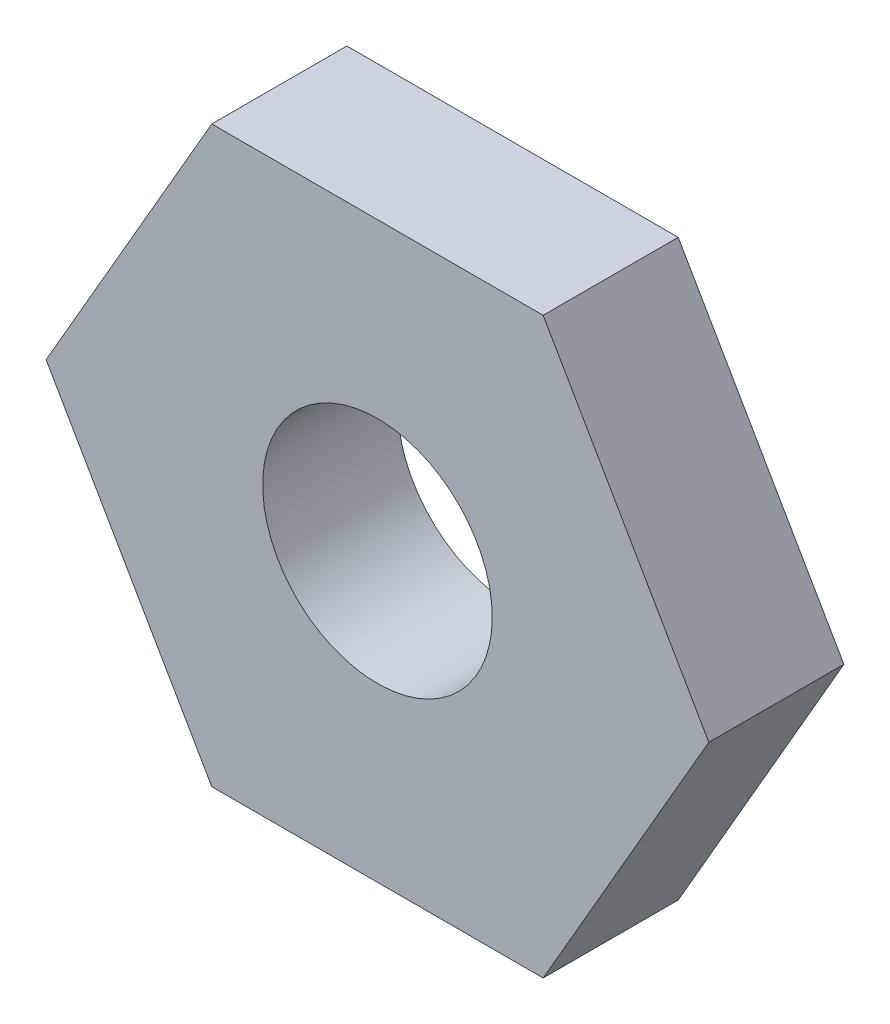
SolidWorks part; units mm, degrees
ref_plane "Face" through (0, 0, 0) normal (0, 0, 1) x (1, 0, 0)
ref_plane "Dessus" through (0, 0, 0) normal (0, 1, 0) x (1, 0, 0)
ref_plane "Droite" through (0, 0, 0) normal (1, 0, 0) x (0, 0, -1)
sketch "Esquisse1" plane through (0, 0, 0) normal (0, 0, 1) x (1, 0, 0)
  line L0 (-9.815, 0) -> (-4.9075, 8.5)
  line L1 (-4.9075, 8.5) -> (4.9075, 8.5)
  line L2 (4.9075, 8.5) -> (9.815, 0)
  line L3 (9.815, 0) -> (4.9075, -8.5)
  line L4 (4.9075, -8.5) -> (-4.9075, -8.5)
  line L5 (-4.9075, -8.5) -> (-9.815, 0)
  circle A0 centre (0, 0) radius 8.5 construction
  dimension "D1" = 17
  dimension "D2" = 120
  dimension "D3" = 120
  dimension "D4" = 120
  dimension "D5" = 120
extrude "Extrusion1" add sketch "Esquisse1" along normal blind 4
hole_wizard "Trou taraudé M8x1.251" positions "Esquisse3" profile "Esquisse2" tap size "M8x1.25" standard "ISO"
sketch "Esquisse3" plane through (0, 0, 4) normal (0, 0, 1) x (1, 0, 0)
  point P0 (0, 0)
sketch "Esquisse2" plane through (0, 0, 4) normal (1, 0, 0) x (0, -1, 0)
  line L0 (0, 0) -> (0, 4)
  line L1 (0, 4) -> (3.4, 4)
  line L2 (3.4, 4) -> (3.4, 0)
  line L5 (3.4, 0) -> (0, 0)
  line L11 (0, -6.35) -> (0, 107.95) construction
  dimension "Diamètre du trou pour taraudage jusqu'au prochain" = 6.8
  dimension "Profondeur du trou pour taraudage jusqu'au prochain" = 4
